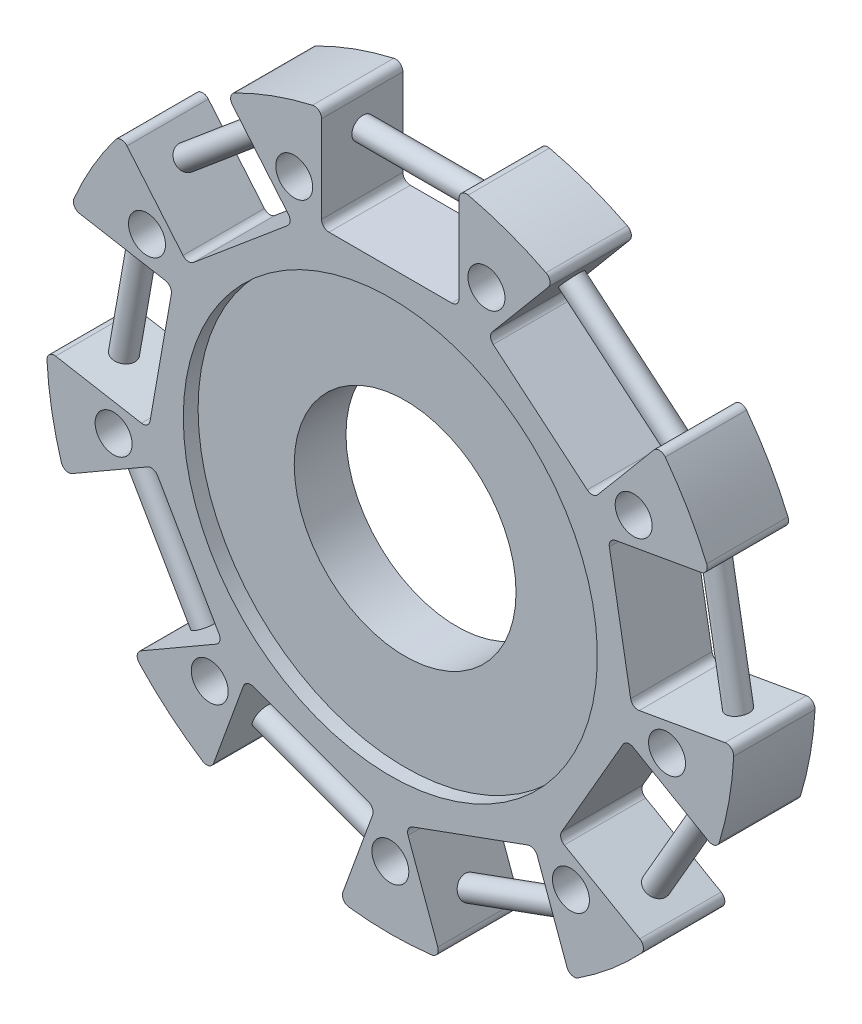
SolidWorks part; units mm, degrees
other "<Om 1>-<CirPattern1>"
ref_plane "Front Plane" through (0, 0, 0) normal (0, 0, 1) x (1, 0, 0)
ref_plane "Top Plane" through (0, 0, 0) normal (0, 1, 0) x (1, 0, 0)
ref_plane "Right Plane" through (0, 0, 0) normal (1, 0, 0) x (0, 0, -1)
mirrored part "Om 1_Mirrored"
